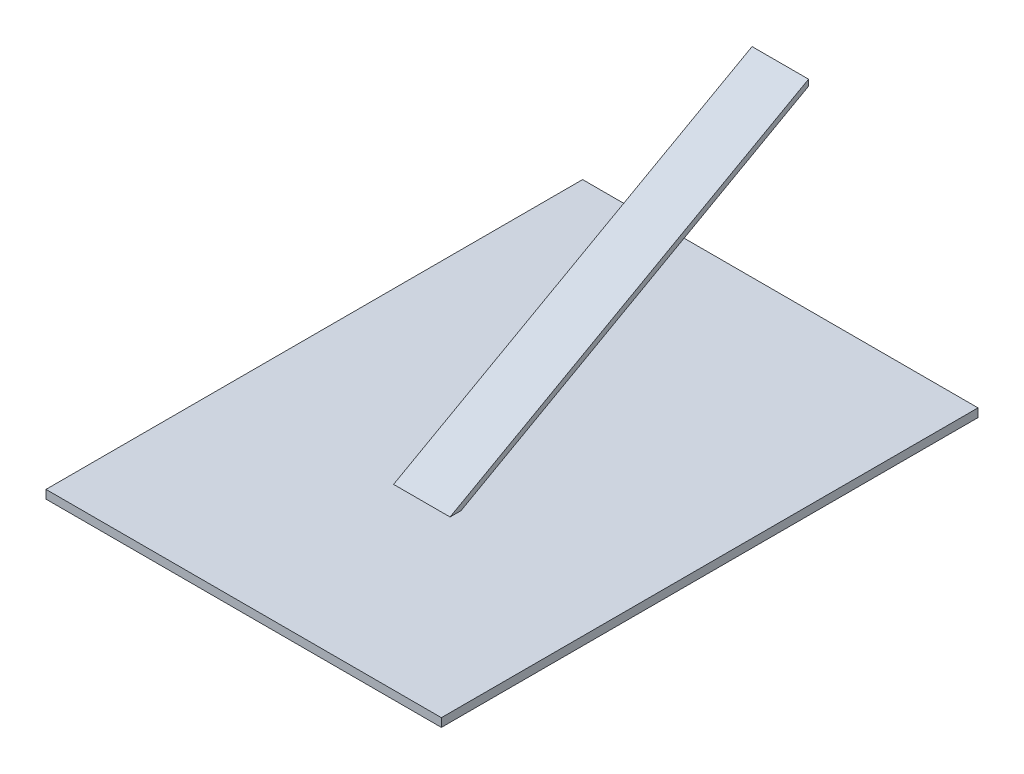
SolidWorks part; units mm, degrees
ref_plane "Спереди" through (0, 0, 0) normal (0, 0, 1) x (1, 0, 0)
ref_plane "Сверху" through (0, 0, 0) normal (0, 1, 0) x (1, 0, 0)
ref_plane "Справа" through (0, 0, 0) normal (1, 0, 0) x (0, 0, -1)
sketch "Sketch1" plane through (0, 0, 0) normal (0, 1, 0) x (1, 0, 0)
  line L1 (-70, 0) -> (70, 0)
  line L2 (-70, 0) -> (-70, 190)
  line L3 (-70, 190) -> (70, 190)
  line L4 (70, 0) -> (70, 190)
  dimension "D1" = 190
  dimension "D2" = 140
extrude "Boss-Extrude1" add sketch "Sketch1" against normal blind 3
sketch "Sketch2" plane through (0, 0, 0) normal (1, 0, 0) x (0, 0, -1)
  line L0 (190, 70.784) -> (63.0624, 0)
  line L1 (0, 0) -> (190, 0) construction
  line L2 (63.0624, 0) -> (66.9434, 0)
  line L3 (66.9434, 0) -> (190, 68.6199)
  line L4 (190, 68.6199) -> (190, 70.784)
extrude "Boss-Extrude2" add sketch "Sketch2" along normal mid plane 20
